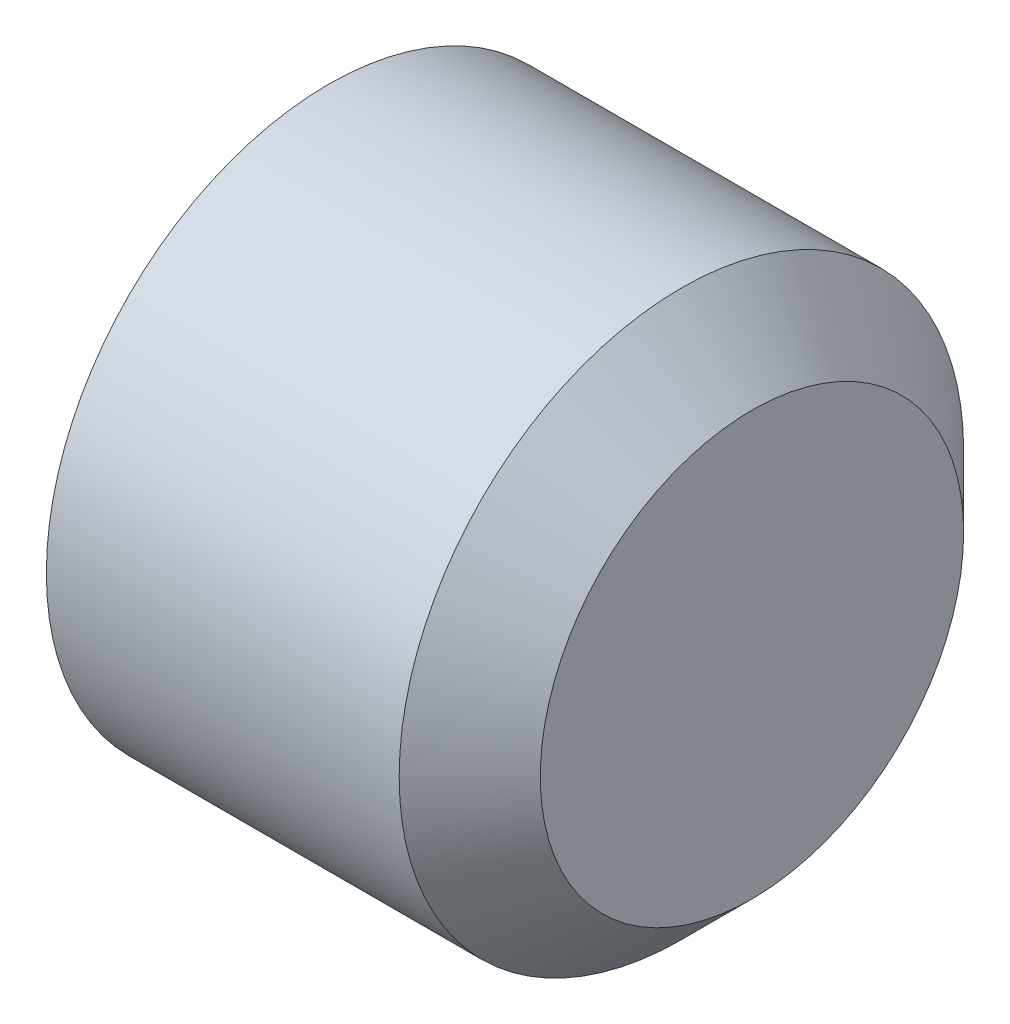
SolidWorks part; units mm, degrees
ref_plane "Plan de face" through (0, 0, 0) normal (0, 0, 1) x (1, 0, 0)
ref_plane "Plan de dessus" through (0, 0, 0) normal (0, 1, 0) x (1, 0, 0)
ref_plane "Plan de droite" through (0, 0, 0) normal (1, 0, 0) x (0, 0, -1)
sketch "Esquisse1" plane through (0, 0, 0) normal (0, 0, 1) x (1, 0, 0)
  line L0 (0, 2) -> (0, 0)
  line L1 (0, 0) -> (3, 0)
  line L2 (3, 0) -> (3, 1.5)
  line L3 (3, 1.5) -> (2.5, 2)
  line L4 (2.5, 2) -> (0, 2)
  line L5 (0, 0) -> (3, 0) construction
revolve "Révolution1" add sketch "Esquisse1" angle 360 about L5
